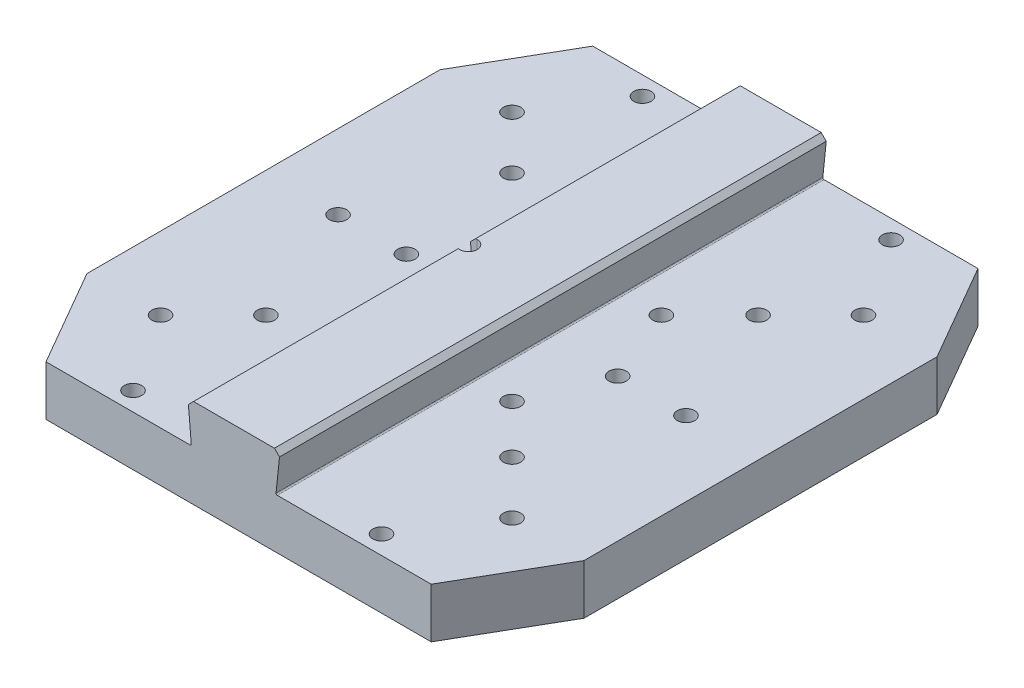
SolidWorks part; units mm, degrees
ref_plane "Plan de face" through (0, 0, 0) normal (0, 0, 1) x (1, 0, 0)
ref_plane "Plan de dessus" through (0, 0, 0) normal (0, 1, 0) x (1, 0, 0)
ref_plane "Plan de droite" through (0, 0, 0) normal (1, 0, 0) x (0, 0, -1)
sketch "Esquisse1" plane through (0, 0, 0) normal (0, 1, 0) x (1, 0, 0)
  line L1 (-200, -220) -> (200, -220)
  line L2 (-200, -220) -> (-200, 220)
  line L3 (-200, 220) -> (200, 220)
  line L4 (200, -220) -> (200, 220)
  line L5 (-200, -220) -> (200, 220) construction
  line L6 (-200, 220) -> (200, -220) construction
  point P0 (0, 0)
  dimension "D1" = 440
  dimension "D2" = 400
extrude "Boss.-Extru.1" add sketch "Esquisse1" against normal blind 40.2
chamfer "Chanfrein1" distance 45 angle 60 4 edges at (-200, -20.1, -220) (200, -20.1, -220) (-200, -20.1, 220) (200, -20.1, 220)
sketch "Esquisse2" plane through (0, 0, 0) normal (0, 0, 1) x (1, 0, 0)
  line L0 (-38, 0) -> (-40.7734, 31.7)
  line L1 (-155, 0) -> (155, 0) construction
  line L2 (-40.7734, 31.7) -> (33.3318, 31.7)
  line L3 (33.3318, 31.7) -> (30, 0)
  line L4 (30, 0) -> (-38, 0)
  line L5 (33.3318, 31.7) -> (33.3318, 2.9644) construction
  line L6 (-40.7734, 31.7) -> (-40.7734, 2.9644) construction
  dimension "D1" = 38
  dimension "D2" = 30
  dimension "D3" = 6
  dimension "D4" = 5
  dimension "D5" = 31.7
extrude "Boss.-Extru.2" add sketch "Esquisse2" along normal up to surface and the other way up to surface
sketch "Esquisse3" plane through (0, 31.7, 0) normal (0, 1, 0) x (1, 0, 0)
  line L0 (-46.5468, 0) -> (-35, 0) construction
  line L1 (-46.5468, 7) -> (-35, 7)
  line L2 (-46.5468, -7) -> (-35, -7)
  line L3 (-40.7734, 0) -> (-40.7734, 36.7256) construction
  line L4 (-40.7734, -220) -> (-40.7734, 220) construction
  arc A0 (-46.5468, 7) -> (-46.5468, -7) centre (-46.5468, 0) ccw
  arc A1 (-35, -7) -> (-35, 7) centre (-35, 0) ccw
  point P3 (-40.7734, 0)
  dimension "D1" = 7
  dimension "D2" = 35
  dimension "D3" = 5.7734
extrude "Enlèv. mat.-Extru.1" cut sketch "Esquisse3" against normal up to surface (31.7 mm away)
chamfer "Chanfrein2" distance 4.5 angle 45 3 edges at (-40.7734, 31.7, -113.5) (-40.7734, 31.7, 113.5) (33.3318, 31.7, 0)
fillet "Congé1" radius 1 3 edges
sketch "Esquisse4" plane through (0, -40.2, 0) normal (0, -1, 0) x (1, 0, 0)
  line L0 (-178.7917, -178.7917) -> (178.7917, 178.7917) construction
  line L1 (-178.7917, 178.7917) -> (178.7917, -178.7917) construction
  line L2 (-200, 0) -> (200, 0) construction
  line L3 (0, 220) -> (0, -220) construction
  line L4 (-155, 220) -> (-200, 142.0577) construction
  line L5 (155, -220) -> (-155, -220) construction
  line L7 (-200, -142.0577) -> (-155, -220) construction
  line L8 (-155, 220) -> (155, 220) construction
  line L9 (100, -205) -> (-100, -205) construction
  line L10 (100, -205) -> (100, 205) construction
  line L11 (100, 205) -> (-100, 205) construction
  line L12 (-100, -205) -> (-100, 205) construction
  line L13 (100, -205) -> (-100, 205) construction
  line L14 (100, 205) -> (-100, -205) construction
  circle A0 centre (0, 0) radius 85 construction
  circle A1 centre (0, 0) radius 140 construction
  circle A2 centre (0, 0) radius 200 construction
  point P13 (141.4214, 141.4214)
  point P20 (98.9949, 98.9949)
  point P21 (60.1041, 60.1041)
  point P22 (85, 0)
  point P23 (140, 0)
  point P24 (0, 200)
  point P25 (0, 140)
  point P26 (0, 85)
  point P27 (-141.4214, 141.4214)
  point P28 (-98.9949, 98.9949)
  point P29 (-60.1041, 60.1041)
  point P30 (-85, 0)
  point P31 (-140, 0)
  point P32 (-60.1041, -60.1041)
  point P33 (-98.9949, -98.9949)
  point P34 (-141.4214, -141.4214)
  point P35 (0, -85)
  point P36 (0, -140)
  point P37 (0, -200)
  point P38 (141.4214, -141.4214)
  point P39 (98.9949, -98.9949)
  point P40 (60.1041, -60.1041)
  dimension "D2" = 170
  dimension "D3" = 280
  dimension "D4" = 400
  dimension "D1" = 45
  dimension "D5" = 200
  dimension "D6" = 15
hole_wizard "Trou taraudé M161" positions "Esquisse6" profile "Esquisse5" tap size "M16" standard "Iso"
sketch "Esquisse6" plane through (0, -40.2, 0) normal (0, -1, 0) x (-1, 0, 0)
  point P0 (-100, -205)
  point P3 (-141.4214, -141.4214)
  point P6 (-98.9949, -98.9949)
  point P9 (-60.1041, -60.1041)
  point P12 (-85, 0)
  point P15 (-140, 0)
  point P18 (-60.1041, 60.1041)
  point P21 (-98.9949, 98.9949)
  point P24 (-141.4214, 141.4214)
  point P27 (-100, 205)
  point P30 (100, 205)
  point P33 (141.4214, 141.4214)
  point P36 (98.9949, 98.9949)
  point P39 (60.1041, 60.1041)
  point P42 (140, 0)
  point P45 (85, 0)
  point P48 (60.1041, -60.1041)
  point P51 (98.9949, -98.9949)
  point P54 (141.4214, -141.4214)
  point P57 (100, -205)
sketch "Esquisse5" plane through (100, -40.2, 205) normal (1, 0, 0) x (0, 0, -1)
  line L0 (0, 0) -> (0, 71.9)
  line L1 (0, 71.9) -> (7, 71.9)
  line L2 (7, 71.9) -> (7, 1.025)
  line L3 (7, 1.025) -> (8.025, 0)
  line L5 (8.025, 0) -> (0, 0)
  line L6 (-7, 1.025) -> (-8.025, 0) construction
  line L11 (0, -6.35) -> (0, 107.95) construction
  dimension "Diamètre du trou pour taraudage jusqu'au prochain" = 14
  dimension "Profondeur du trou pour taraudage jusqu'au prochain" = 71.9
  dimension "Diamètre du fraisage entrant" = 16.05
  dimension "Angle du fraisage entrant" = 90
hole_wizard "Trou taraudé M162" positions "Esquisse8" profile "Esquisse7" tap size "M16" standard "Iso"
sketch "Esquisse8" plane through (0, -40.2, 0) normal (0, -1, 0) x (-1, 0, 0)
  point P0 (0, -200)
  point P3 (0, -140)
  point P6 (0, -85)
  point P9 (0, 85)
  point P12 (0, 140)
  point P15 (0, 200)
sketch "Esquisse7" plane through (0, -40.2, 200) normal (1, 0, 0) x (0, 0, -1)
  line L0 (0, 0) -> (0, 46.206)
  line L1 (0, 46.206) -> (7, 42)
  line L2 (7, 42) -> (7, 1.025)
  line L3 (7, 1.025) -> (8.025, 0)
  line L5 (8.025, 0) -> (0, 0)
  line L6 (-7, 1.025) -> (-8.025, 0) construction
  line L10 (0, 46.206) -> (-7, 42) construction
  line L11 (0, -6.35) -> (0, 107.95) construction
  dimension "Diamètre du trou pour taraudage" = 14
  dimension "Profondeur du trou pour taraudage" = 42
  dimension "Diamètre du fraisage entrant" = 16.05
  dimension "Angle du fraisage entrant" = 90
  dimension "Angle de pointe" = 118
